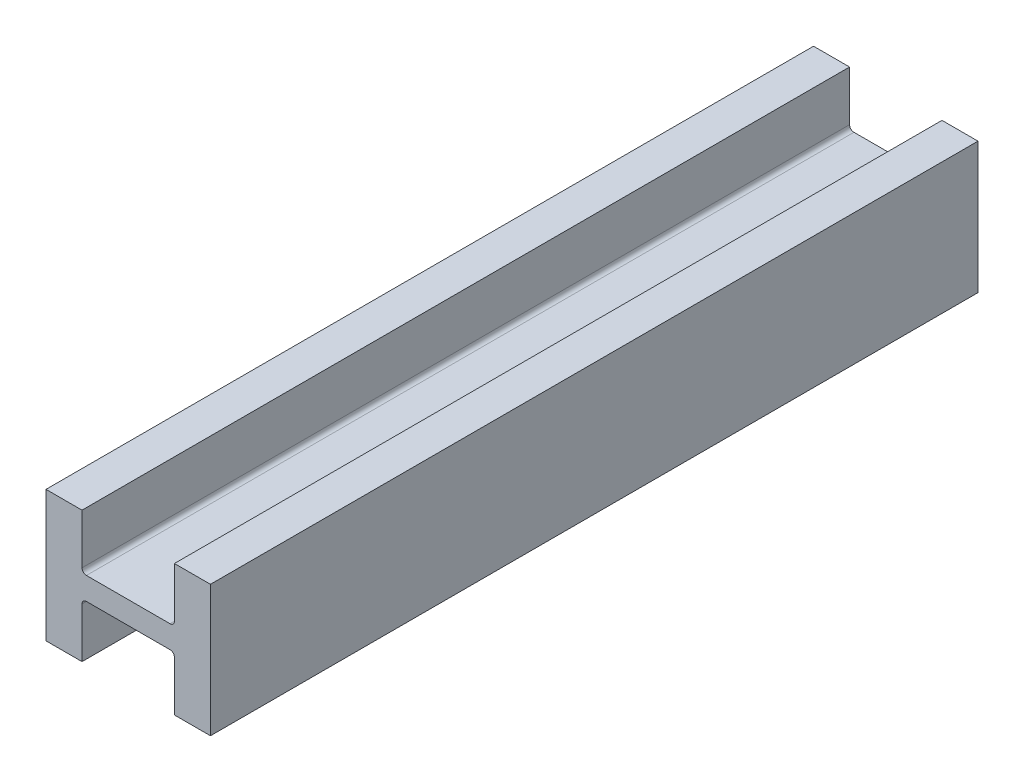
SolidWorks part; units mm, degrees
ref_plane "Front Plane" through (0, 0, 0) normal (1, 0, 0) x (0, 1, 0)
ref_plane "Top Plane" through (0, 0, 0) normal (0, 0, 1) x (0, 1, 0)
ref_plane "Right Plane" through (0, 0, 0) normal (0, 1, 0) x (-1, 0, 0)
sketch "sk W14x730" plane through (0, 0, 0) normal (0, 0, 1) x (0, 1, 0)
  point P0 (-227.203, -284.734)
  point P1 (0, -284.734)
  point P2 (-38.989, 0)
  line B0 (-227.203, -284.734) -> (-227.203, -160.02)
  line B1 (-227.203, -160.02) -> (-54.229, -160.02)
  line B2 (-38.989, -144.78) -> (-38.989, 144.78)
  line B3 (-54.229, 160.02) -> (-227.203, 160.02)
  line B4 (-227.203, 160.02) -> (-227.203, 284.734)
  line B5 (-227.203, 284.734) -> (227.203, 284.734)
  line B6 (227.203, 284.734) -> (227.203, 160.02)
  line B7 (227.203, 160.02) -> (54.229, 160.02)
  line B8 (38.989, 144.78) -> (38.989, -144.78)
  line B9 (54.229, -160.02) -> (227.203, -160.02)
  line B10 (227.203, -160.02) -> (227.203, -284.734)
  line B11 (227.203, -284.734) -> (-227.203, -284.734)
  arc B12 (-54.229, -160.02) -> (-38.989, -144.78) centre (-54.229, -144.78) ccw
  arc B13 (-38.989, 144.78) -> (-54.229, 160.02) centre (-54.229, 144.78) ccw
  arc B14 (54.229, 160.02) -> (38.989, 144.78) centre (54.229, 144.78) ccw
  arc B15 (38.989, -144.78) -> (54.229, -160.02) centre (54.229, -144.78) ccw
sketch_block_instance "W14x730-1"
sketch_block "W14x730" parameters "D4"=15.24, "D1"=454.406, "D2"=569.468, "D3"=77.978, "D5"=124.714, "D6"=6.35
extrude "Beam Body" add sketch "sk W14x730" along normal mid plane 2658.1
